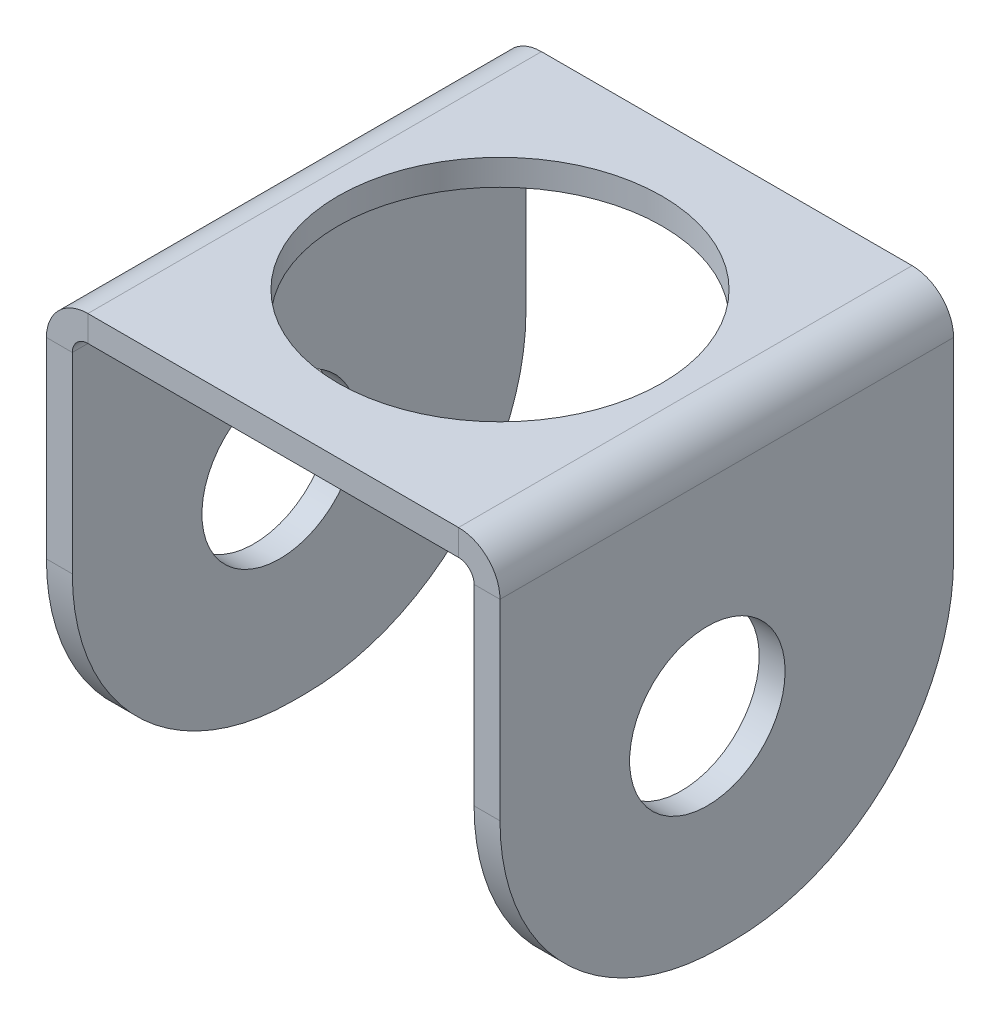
SolidWorks part; units mm, degrees
ref_plane "Plan1" through (0, 0, 0) normal (0, 0, 1) x (1, 0, 0)
ref_plane "Plan2" through (0, 0, 0) normal (0, 1, 0) x (1, 0, 0)
ref_plane "Plan3" through (0, 0, 0) normal (1, 0, 0) x (0, 0, -1)
sketch "Esquisse1" plane through (0, 0, 0) normal (0, 0, 1) x (1, 0, 0)
  line L0 (-17.5, -35) -> (-17.5, 0)
  line L1 (-17.5, 0) -> (17.5, 0)
  line L2 (17.5, 0) -> (17.5, -35)
  line L3 (0, 12.7184) -> (0, -12.7184) construction
  dimension "D1" = 35
extrude "Base-Extru.-Mince" add sketch "Esquisse1" along normal mid plane 35 thin
sketch "Esquisse2" plane through (0, 0, 0) normal (1, 0, 0) x (0, 0, -1)
  line L0 (17.5, -35) -> (17.5, -2) construction
  line L1 (-17.5, 0) -> (17.5, 0) construction
  circle A0 centre (-1.5, -19) radius 6
  dimension "D2" = 12
  dimension "D1" = 19
  dimension "D3" = 19
extrude "Enlèv. mat.-Extru.1" cut sketch "Esquisse2" against normal through all and the other way through all
fillet "Congé1" radius 17
sketch "Esquisse3"
  circle A0 centre (0, 0) radius 12.5
  dimension "D1" = 25
bend "Pli dans angle2" parameters "D1"=0
flatten bends "Dépliage 1" parameters "D1"=0
sketch "Esquisse-Angle1" plane through (17.5, 0, 0) normal (1, 0, 0) x (0, 0, -1)
  line L0 (-17.5, -2.7) -> (17.5, -2.7) construction
  line L1 (-17.5, 26.9) -> (17.5, 26.9) construction
bend "Pli dans angle1" bend angle 90 parameters "D1"=0, "D5"=1
sheet metal parameters "Tôlerie 1" thickness 1.2 parameters "D1"=1.2, "D4"=90, "D5"=2
extrude "Enlèv. mat.-Extru.2" cut sketch "Esquisse3" against normal through all
process bends "Pliage 1" parameters "D1"=0, "Epaisseur"=3
sketch "Esquisse-Plate1" plane through (17.5, 0, 0) normal (1, 0, 0) x (0, 0, -1)
